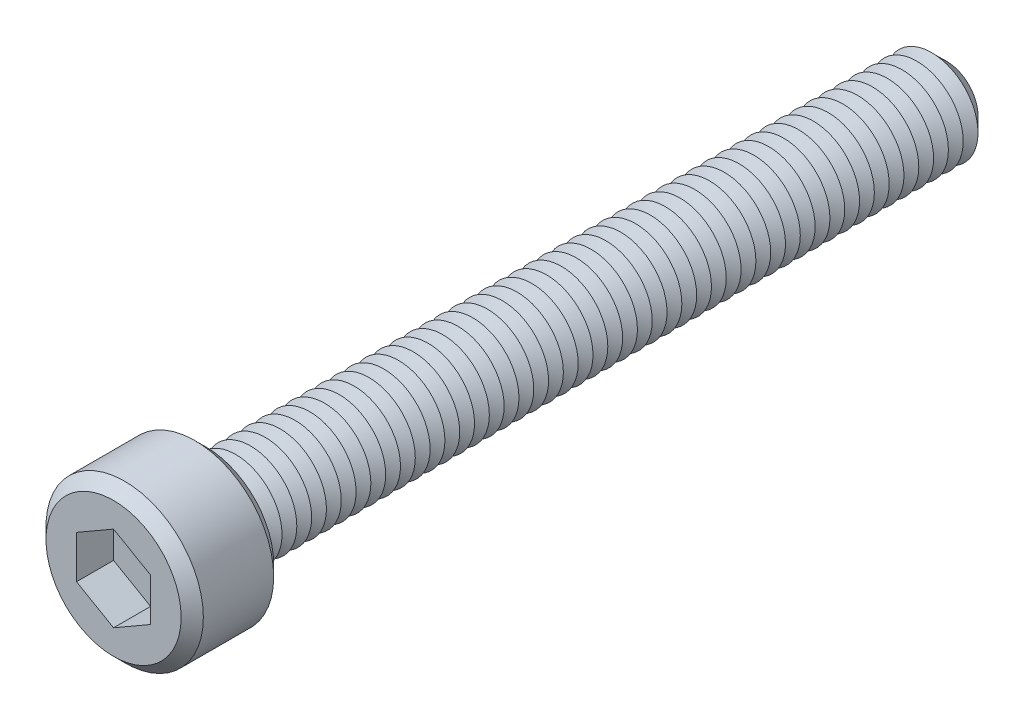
SolidWorks part; units mm, degrees
ref_plane "Front Plane" through (0, 0, 0) normal (0, 0, 1) x (1, 0, 0)
ref_plane "Top Plane" through (0, 0, 0) normal (0, 1, 0) x (1, 0, 0)
ref_plane "Right Plane" through (0, 0, 0) normal (1, 0, 0) x (0, 0, -1)
sketch "Sketch1" plane through (0, 0, 0) normal (0, 0, 1) x (1, 0, 0)
  circle A0 centre (0, 0) radius 4.25
  dimension "D1" = 8.5
extrude "Boss-Extrude1" add sketch "Sketch1" along normal blind 5
sketch "Sketch2" plane through (0, 0, 0) normal (0, 0, -1) x (-1, 0, 0)
  circle A0 centre (0, 0) radius 2.5
  dimension "D1" = 5
extrude "Boss-Extrude2" add sketch "Sketch2" along normal blind 40
chamfer "Chamfer1" distance 0.8 angle 45 1 edges at (-2.5, 0, -40)
sketch "Sketch3" plane through (0, 0, 0) normal (1, 0, 0) x (0, 0, -1)
  line L0 (-2.5121, 0) -> (4.5776, 0) construction
sketch "Sketch4" plane through (0, 0, 0) normal (1, 0, 0) x (0, 0, -1)
  line L0 (0, 2.5) -> (0.4, 1.8072)
  line L1 (0.4, 1.8072) -> (0.8, 2.5)
  line L2 (39.2, 2.5) -> (0, 2.5) construction
  line L3 (0.8, 2.5) -> (0, 2.5)
  dimension "D1" = 0.8
revolve "Cut-Revolve1" cut sketch "Sketch4" angle 360 about L0
pattern_linear "LPattern1" count 49 spacing 0.8 along (0, 0, -1) of "Cut-Revolve1"
sketch "Sketch5" plane through (0, 0, 5) normal (0, 0, 1) x (1, 0, 0)
  line L1 (0, 2.3094) -> (-2, 1.1547)
  line L2 (-2, 1.1547) -> (-2, -1.1547)
  line L3 (-2, -1.1547) -> (0, -2.3094)
  line L4 (0, -2.3094) -> (2, -1.1547)
  line L5 (2, -1.1547) -> (2, 1.1547)
  line L6 (2, 1.1547) -> (0, 2.3094)
  circle A0 centre (0, 0) radius 2 construction
  dimension "D1" = 4
extrude "Cut-Extrude1" cut sketch "Sketch5" against normal blind 2
sketch "Sketch6" plane through (0, 0, 3) normal (0, 0, 1) x (1, 0, 0)
  circle A0 centre (0, 0) radius 0.65
  dimension "D1" = 1.3
extrude "Cut-Extrude2" cut sketch "Sketch6" against normal up to surface (43 mm away)
chamfer "Chamfer2" distance 0.6 angle 45 2 edges at (4.25, 0, 0) (4.25, 0, 5)
